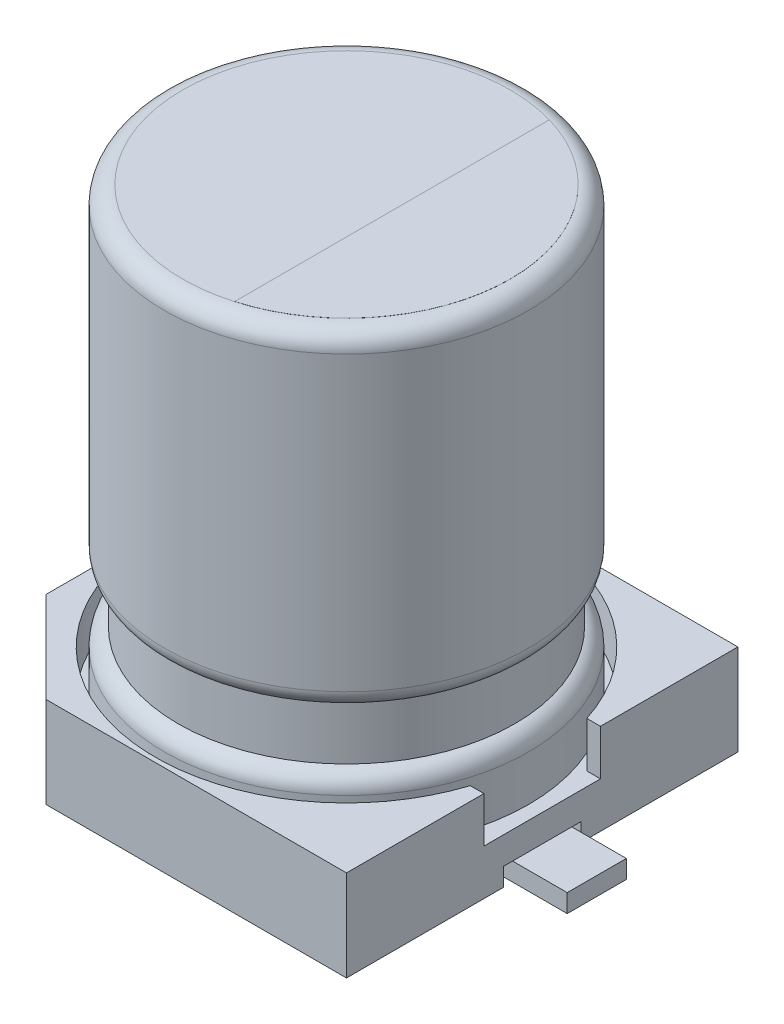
SolidWorks part; units mm, degrees
ref_plane "Front" through (0, 0, 0) normal (0, 0, 1) x (1, 0, 0)
ref_plane "Top" through (0, 0, 0) normal (0, 1, 0) x (1, 0, 0)
ref_plane "Right" through (0, 0, 0) normal (1, 0, 0) x (0, 0, -1)
sketch "Эскиз1" plane through (0, 0, 0) normal (0, 0, 1) x (1, 0, 0)
  line L0 (0, 0) -> (-2, 0)
  line L1 (-2, 0) -> (-2, 1)
  line L2 (-2, 1.9873) -> (-2, 5.2)
  line L3 (-1.8, 5.4) -> (0, 5.4)
  line L4 (0, 5.4) -> (0, 0) construction
  line L5 (-1.85, 1.7936) -> (-1.85, 1.1936)
  line L6 (0, 0) -> (0, 5.4)
  arc A0 (-2, 1) -> (-1.85, 1.1936) centre (-1.8, 1) cw
  arc A2 (-1.85, 1.7936) -> (-2, 1.9873) centre (-1.8, 1.9873) cw
  arc A3 (-2, 5.2) -> (-1.8, 5.4) centre (-1.8, 5.2) cw
  dimension "D1" = 0.2
  dimension "D4" = 0.2
  dimension "D" = 4
  dimension "L" = 5.4
  dimension "D5" = 0.15
  dimension "D6" = 1
  dimension "D7" = 0.6
revolve "Повернуть1" add sketch "Эскиз1" angle 360 about L4
sketch "Эскиз6" plane through (0, 5.4, 0) normal (0, 1, 0) x (1, 0, 0)
  line L0 (0.5, 1.7292) -> (0.5, -1.7292)
  circle A0 centre (0, 0) radius 1.8 construction
  arc A1 (0.5, -1.7292) -> (0.5, 1.7292) centre (0, 0) ccw
  dimension "D1" = 0.5
extrude "Вытянуть5" add sketch "Эскиз6" along normal blind 0.001
sketch "Эскиз2" plane through (0, 0, 0) normal (0, 1, 0) x (1, 0, 0)
  line L0 (-1.15, 2.15) -> (-2.15, 1.15)
  line L1 (2.15, -2.15) -> (-1.15, -2.15)
  line L2 (2.15, -2.15) -> (2.15, 2.15)
  line L3 (2.15, 2.15) -> (-1.15, 2.15)
  line L4 (-2.15, -1.15) -> (-2.15, 1.15)
  line L5 (2.15, -2.15) -> (-2.15, 2.15) construction
  line L6 (2.15, 2.15) -> (-2.15, -2.15) construction
  line L7 (-1.15, -2.15) -> (-2.15, -1.15)
  point P0 (0, 0)
  dimension "A" = 4.3
  dimension "A45" = 1
extrude "Вытянуть1" add sketch "Эскиз2" along normal blind 0.5
sketch "Эскиз3" plane through (0, 0.5, 0) normal (0, 1, 0) x (1, 0, 0)
  line L6 (0, 0) -> (-0.6995, 0) construction
  line L7 (-2.15, 1.15) -> (-2.15, -1.15) construction
  line L8 (-2.15, -0.6403) -> (-2.15, -1.15)
  line L9 (-2.15, -0.6403) -> (-2, -0.6403)
  line L10 (-2.15, 0.6403) -> (-2, 0.6403)
  line L11 (2, 0.6403) -> (2.15, 0.6403)
  line L12 (2.15, -2.15) -> (2.15, 2.15)
  line L13 (2.15, 2.15) -> (-1.15, 2.15)
  line L14 (-1.15, 2.15) -> (-2.15, 1.15)
  line L15 (-2.15, 1.15) -> (-2.15, -1.15)
  line L16 (-2.15, -1.15) -> (-1.15, -2.15)
  line L17 (-1.15, -2.15) -> (2.15, -2.15)
  line L18 (2.15, -2.15) -> (2.15, -0.6403)
  line L19 (2.15, 2.15) -> (-1.15, 2.15)
  line L20 (-1.15, 2.15) -> (-2.15, 1.15)
  line L21 (-2.15, 1.15) -> (-2.15, 0.6403)
  line L22 (-2.15, -1.15) -> (-1.15, -2.15)
  line L23 (-1.15, -2.15) -> (2.15, -2.15)
  line L24 (2, -0.6403) -> (2.15, -0.6403)
  line L25 (2.15, 0.6403) -> (2.15, 2.15)
  arc A1 (2, 0.6403) -> (-2, 0.6403) centre (0, 0) ccw
  circle A2 centre (0, 0) radius 2.1
  arc A3 (-2, -0.6403) -> (2, -0.6403) centre (0, 0) ccw
  dimension "D3" = 0.15
  dimension "D4" = 0.15
  dimension "D1" = 0
  dimension "D2" = 0.1
extrude "Вытянуть2" add sketch "Эскиз3" along normal blind 0.5
sketch "Эскиз4" plane through (0, 0, 0) normal (0, -1, 0) x (1, 0, 0)
  line L0 (-2.15, 0) -> (2.15, 0) construction
  line L1 (-2.15, 0.425) -> (-0.4, 0.425)
  line L2 (-2.15, 0.425) -> (-2.15, -0.425)
  line L3 (-2.15, -0.425) -> (-0.4, -0.425)
  line L4 (-0.4, 0.425) -> (-0.4, -0.425)
  line L5 (0.4, 0.425) -> (0.4, -0.425)
  line L6 (2.15, -0.425) -> (0.4, -0.425)
  line L7 (2.15, 0.425) -> (2.15, -0.425)
  line L8 (2.15, 0.425) -> (0.4, 0.425)
  line L9 (-2.15, -1.15) -> (-2.15, 1.15) construction
  line L10 (2.15, 2.15) -> (2.15, -2.15) construction
  line L11 (0, 0) -> (0, -2.15) construction
  line L12 (2.15, -2.15) -> (-1.15, -2.15) construction
  dimension "W02" = 0.85
  dimension "P02" = 0.8
extrude "Вытянуть3" cut sketch "Эскиз4" against normal blind 0.2
sketch "Эскиз5" plane through (0, 0, 0) normal (0, 1, 0) x (1, 0, 0)
  line L0 (0, 0) -> (0, 2.15) construction
  line L1 (-2.75, 0.325) -> (-0.5, 0.325)
  line L2 (-2.75, 0.325) -> (-2.75, -0.325)
  line L3 (-2.75, -0.325) -> (-0.5, -0.325)
  line L4 (-0.5, 0.325) -> (-0.5, -0.325)
  line L5 (2.15, 2.15) -> (-1.15, 2.15) construction
  line L6 (0.5, 0.325) -> (0.5, -0.325)
  line L7 (2.75, -0.325) -> (0.5, -0.325)
  line L8 (2.75, 0.325) -> (2.75, -0.325)
  line L9 (2.75, 0.325) -> (0.5, 0.325)
  line L10 (0, 0) -> (-2.75, 0) construction
  dimension "P" = 1
  dimension "W" = 0.65
  dimension "H" = 5.5
extrude "Вытянуть4" add sketch "Эскиз5" along normal up to surface (0.2 mm away)
